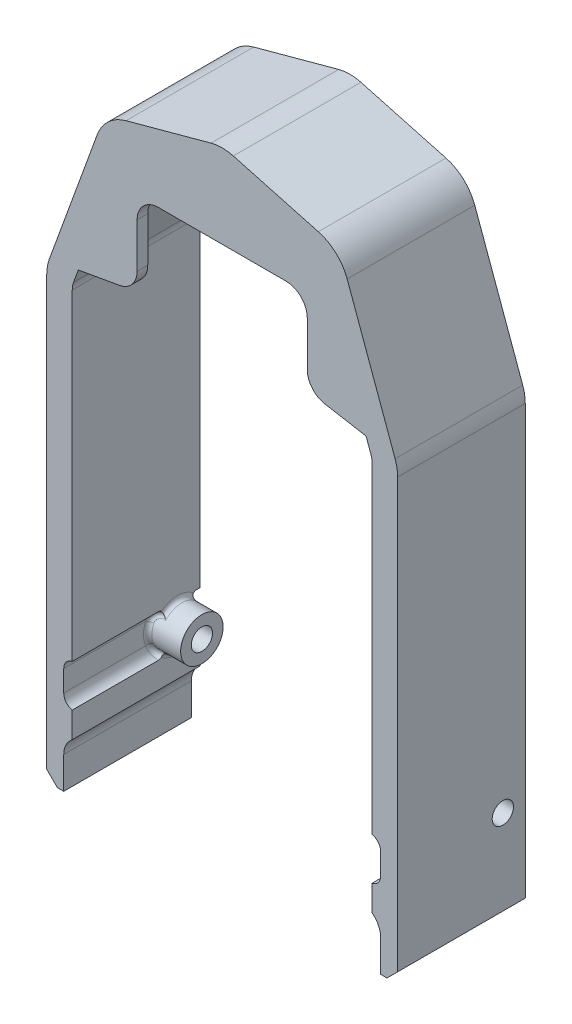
SolidWorks part; units mm, degrees
ref_plane "Face" through (0, 0, 0) normal (0, 0, 1) x (1, 0, 0)
ref_plane "Dessus" through (0, 0, 0) normal (0, 1, 0) x (1, 0, 0)
ref_plane "Droite" through (0, 0, 0) normal (1, 0, 0) x (0, 0, -1)
sketch "Esquisse1" plane through (0, 0, 0) normal (0, 0, 1) x (1, 0, 0)
  line L0 (-74.5, 0) -> (-82.5, 0)
  line L1 (-82.5, 0) -> (-82.5, 206.4735)
  line L2 (-81.2939, 213.3139) -> (-58.7478, 275.2586)
  line L3 (-45.1984, 287.7183) -> (0, 300)
  line L4 (0, 300) -> (0, 287.5649)
  line L5 (0, 287.5649) -> (-41.0513, 276.4101)
  line L6 (-47.8261, 270.1802) -> (-69.8969, 209.541)
  line L7 (-70.5, 206.1208) -> (-70.5, 54.899)
  line L8 (-74.5, 0) -> (-74.5, 15)
  line L9 (-74.5, 50) -> (-74.5, 40)
  line L10 (-70.5, 35.101) -> (-70.5, 23)
  arc A0 (-74.5, 15) -> (-70.5, 23) centre (-64.5, 15) cw
  arc A1 (-74.5, 40) -> (-70.5, 35.101) centre (-69.5, 40) ccw
  arc A2 (-74.5, 50) -> (-70.5, 54.899) centre (-69.5, 50) cw
  arc A3 (-41.0513, 276.4101) -> (-47.8261, 270.1802) centre (-38.4291, 266.76) ccw
  arc A4 (-69.8969, 209.541) -> (-70.5, 206.1208) centre (-60.5, 206.1208) ccw
  arc A5 (-82.5, 206.4735) -> (-81.2939, 213.3139) centre (-62.5, 206.4735) cw
  arc A6 (-58.7478, 275.2586) -> (-45.1984, 287.7183) centre (-39.954, 268.4182) cw
  point P24 (-82.5, 210)
  point P27 (-55.2022, 285)
  dimension "D9" = 10
  dimension "D10" = 20
  dimension "D13" = 10
  dimension "D14" = 5
  dimension "D15" = 5
  dimension "D1" = 12
  dimension "D2" = 12
  dimension "D3" = 160
  dimension "D4" = 75
  dimension "D5" = 12
  dimension "D6" = 82.5
  dimension "D7" = 300
  dimension "D8" = 210
  dimension "D11" = 8
  dimension "D12" = 15
  dimension "D16" = 40
  dimension "D17" = 10
extrude "Base-Extrusion" add sketch "Esquisse1" along normal blind 60
sketch "Esquisse2" plane through (0, 0, 60) normal (0, 0, 1) x (1, 0, 0)
  line L0 (0, 300) -> (0, 260)
  line L1 (0, 260) -> (-30, 260)
  line L2 (-40, 250) -> (-40, 228.9861)
  line L3 (-48.2635, 219.138) -> (-81.2939, 213.3139)
  line L4 (0, 300) -> (-45.1984, 287.7183)
  line L5 (-81.2939, 213.3139) -> (-58.7478, 275.2586)
  line L10 (0, 300) -> (-45.1984, 287.7183) construction
  line L11 (-58.7478, 275.2586) -> (-81.2939, 213.3139) construction
  arc A0 (-81.2939, 213.3139) -> (-82.5, 206.4735) centre (-62.5, 206.4735) ccw construction
  arc A1 (-45.1984, 287.7183) -> (-58.7478, 275.2586) centre (-39.954, 268.4182) ccw
  arc A2 (-30, 260) -> (-40, 250) centre (-30, 250) ccw
  arc A3 (-48.2635, 219.138) -> (-40, 228.9861) centre (-50, 228.9861) ccw
  point P18 (-40, 260)
  point P23 (0, 260)
  dimension "D3" = 20
  dimension "D5" = 10
  dimension "D6" = 10
  dimension "D1" = 40
  dimension "D2" = 40
  dimension "D4" = 100
extrude "Boss.-Extru.1" add sketch "Esquisse2" against normal blind 5
sketch "Esquisse3" plane through (-74.5, 0, 0) normal (1, 0, 0) x (0, 0, -1)
  circle A0 centre (-10.54, 45) radius 10
  dimension "D1" = 45
  dimension "D3" = 20
  dimension "D2" = 49.46
extrude "Boss.-Extru.2" add sketch "Esquisse3" along normal blind 15.5
fillet "Congé2" radius 2
sketch "Esquisse4" plane through (-59, 0, 0) normal (1, 0, 0) x (0, 0, -1)
  circle A0 centre (-10.54, 45) radius 5
  dimension "D1" = 10
extrude "Enlèv. mat.-Extru.1" cut sketch "Esquisse4" against normal through all
mirror "Symétrie1"
fillet "Congé3" radius 20
chamfer "Chanfrein1" distance 5 angle 45
